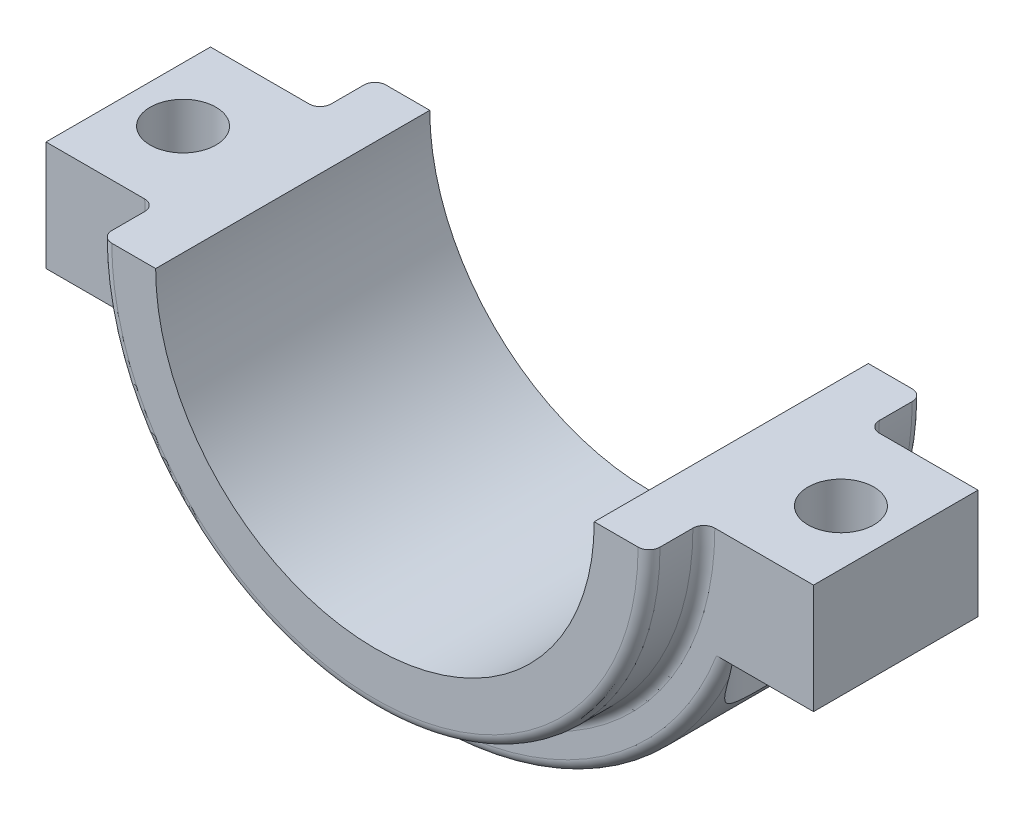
SolidWorks part; units mm, degrees
ref_plane "Płaszczyzna przednia" through (0, 0, 0) normal (0, 0, 1) x (1, 0, 0)
ref_plane "Płaszczyzna górna" through (0, 0, 0) normal (0, 1, 0) x (1, 0, 0)
ref_plane "Płaszczyzna prawa" through (0, 0, 0) normal (1, 0, 0) x (0, 0, -1)
sketch "Szkic1" plane through (0, 0, 0) normal (0, 0, 1) x (1, 0, 0)
  line L0 (40, 0) -> (70, 0)
  line L1 (-70, 0) -> (-40, 0)
  line L2 (-70, 0) -> (-70, -20)
  line L3 (-70, -20) -> (-54.4426, -20)
  line L4 (70, 0) -> (70, -20)
  line L5 (54.4426, -20) -> (70, -20)
  arc A0 (-54.4426, -20) -> (54.4426, -20) centre (0, 0) ccw
  arc A1 (-40, 0) -> (40, 0) centre (0, 0) ccw
  dimension "D3" = 40
  dimension "D4" = 58
  dimension "D1" = 140
  dimension "D2" = 20
extrude "Wyciągnięcie1" add sketch "Szkic1" along normal mid plane 30
sketch "Szkic2" plane through (0, 0, 0) normal (0, 0, 1) x (1, 0, 0)
  line L0 (70, 0) -> (40, 0) construction
  line L1 (-40, 0) -> (-70, 0) construction
  line L2 (-50, 0) -> (-40, 0)
  line L3 (40, 0) -> (50, 0)
  arc A0 (-40, 0) -> (40, 0) centre (0, 0) ccw construction
  arc A1 (-40, 0) -> (40, 0) centre (0, 0) ccw
  arc A2 (50, 0) -> (-50, 0) centre (0, 0) cw
  dimension "D1" = 50
extrude "Wyciągnięcie2" add sketch "Szkic2" along normal mid plane 50
sketch "Szkic3" plane through (0, -20, 0) normal (0, -1, 0) x (1, 0, 0)
  line L0 (0, 0) -> (0, 25) construction
  line L1 (50, 25) -> (-50, 25) construction
  circle A0 centre (-60, 0) radius 6
  dimension "D2" = 12
  dimension "D1" = 120
extrude "Wyciągnięcie3" cut sketch "Szkic3" against normal through all
sketch "Szkic4" plane through (0, -20, 0) normal (0, -1, 0) x (1, 0, 0)
  circle A0 centre (-60, 0) radius 15
  dimension "D1" = 15
extrude "Wyciągnięcie4" cut sketch "Szkic4" along normal through all
mirror "Lustro1" about plane through (0, 0, 0) normal (1, 0, 0) of "Wyciągnięcie3", "Wyciągnięcie4"
fillet "Zaokrąglenie1" radius 2 6 edges at (0, -50, 25) (0, -50, 15) (0, -58, 15) (0, -58, -15) (0, -50, -15) (0, -50, -25)
